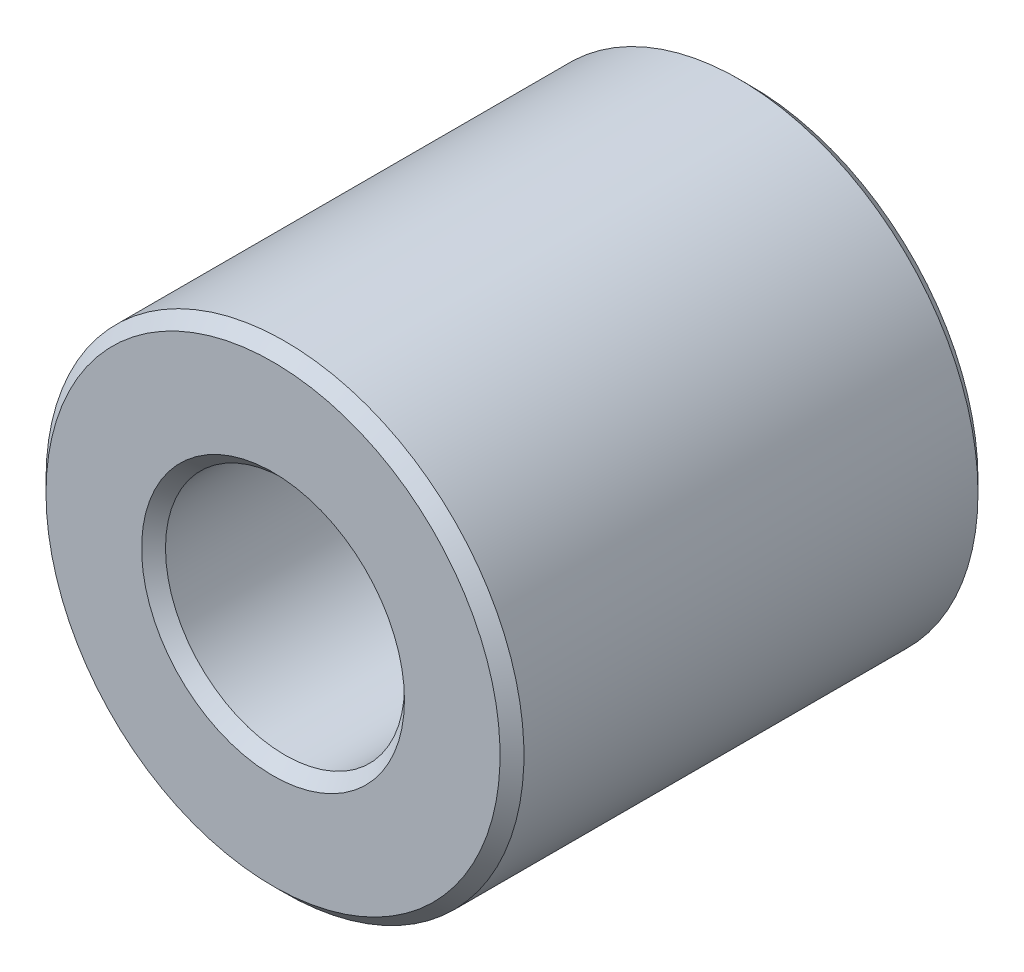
SolidWorks part; units mm, degrees
ref_plane "Front Plane" through (0, 0, 0) normal (0, 0, 1) x (1, 0, 0)
ref_plane "Top Plane" through (0, 0, 0) normal (0, 1, 0) x (1, 0, 0)
ref_plane "Right Plane" through (0, 0, 0) normal (1, 0, 0) x (0, 0, -1)
sketch "Sketch1" plane through (0, 0, 0) normal (0, 0, 1) x (1, 0, 0)
  circle A0 centre (0, 0) radius 15
  circle A1 centre (0, 0) radius 30
  dimension "D1" = 30
  dimension "D2" = 60
extrude "Boss-Extrude1" add sketch "Sketch1" along normal mid plane 60
chamfer "Chamfer1" distance 1.5 angle 45 4 edges at (15, 0, -30) (30, 0, -30) (15, 0, 30) (30, 0, 30)
